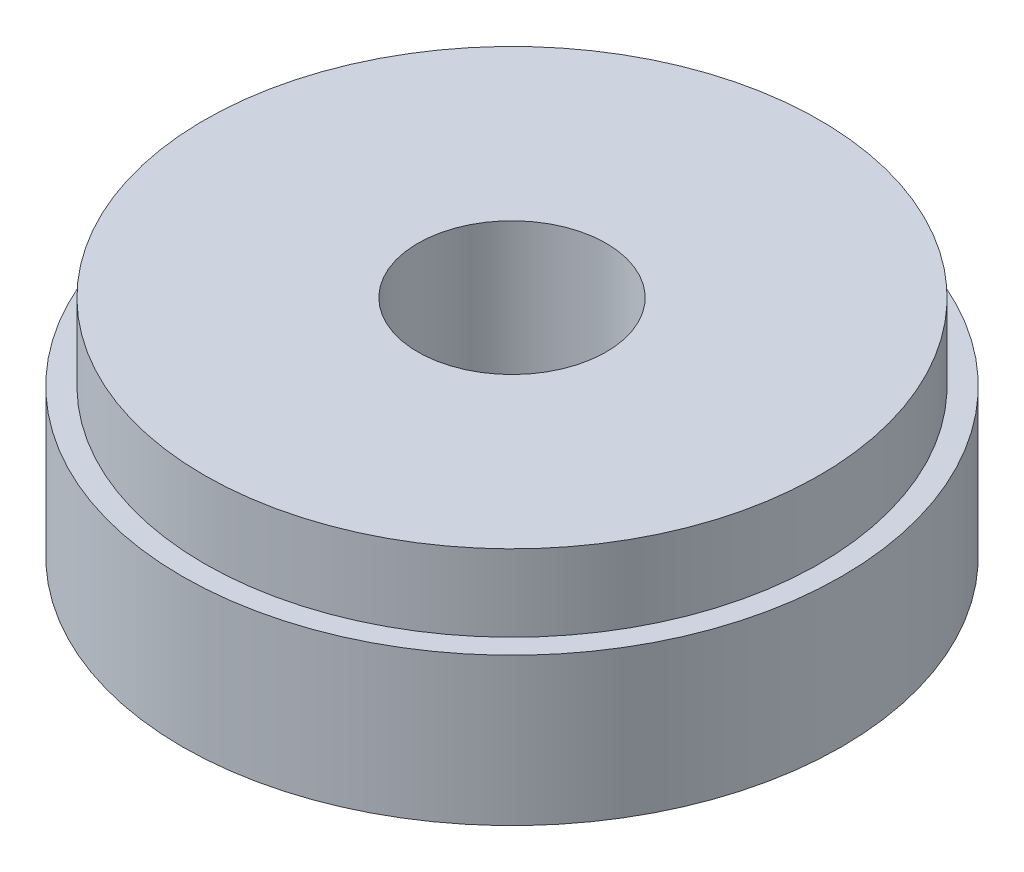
SolidWorks part; units mm, degrees
ref_plane "Front Plane" through (0, 0, 0) normal (0, 0, 1) x (1, 0, 0)
ref_plane "Top Plane" through (0, 0, 0) normal (0, 1, 0) x (1, 0, 0)
ref_plane "Right Plane" through (0, 0, 0) normal (1, 0, 0) x (0, 0, -1)
sketch "Sketch1" plane through (0, 0, 0) normal (0, 1, 0) x (1, 0, 0)
  circle A0 centre (0, 0) radius 21
  dimension "D1" = 42
extrude "Extrude1" add sketch "Sketch1" along normal blind 14.2748
sketch "Sketch2" plane through (0, 0, 0) normal (0, -1, 0) x (1, 0, 0)
  circle A0 centre (0, 0) radius 14
  dimension "D1" = 28
extrude "Extrude2" add sketch "Sketch2" along normal blind 3
sketch "Sketch6" plane through (0, 14.2748, 0) normal (0, 1, 0) x (-1, 0, 0)
  circle A0 centre (0, 0) radius 19.5961
  dimension "D1" = 39.1922
sketch "Sketch3" plane through (0, -3, 0) normal (0, -1, 0) x (1, 0, 0)
  circle A0 centre (0, 0) radius 6
  dimension "D1" = 12
extrude "Cut-Extrude1" cut sketch "Sketch3" against normal through all
hole_wizard "M4x0.7 Tapped Hole1" positions "Sketch5" profile "Sketch4" tap size "M4x0.7" standard "Ansi Metric"
sketch "Sketch5" plane through (0, 0, 0) normal (0, -1, 0) x (1, 0, 0)
  point P0 (17.5, 0)
  dimension "D1" = 17.5
sketch "Sketch4" plane through (17.5, 0, 0) normal (1, 0, 0) x (0, 0, -1)
  line L0 (0, 0) -> (0, 11.0914)
  line L1 (0, 11.0914) -> (1.65, 10.1)
  line L2 (1.65, 10.1) -> (1.65, 8)
  line L3 (1.65, 8) -> (2, 8)
  line L4 (2, 8) -> (2, 0)
  line L5 (2, 0) -> (0, 0)
  line L10 (0, 11.0914) -> (-1.65, 10.1) construction
  line L11 (0, -6.35) -> (0, 107.95) construction
  dimension "Tap Drill Dia." = 3.3
  dimension "Tap Drill Depth" = 10.1
  dimension "Thread Major Dia." = 4
  dimension "Thread Depth" = 8
  dimension "Drill Angle" = 118
pattern_circular "CirPattern1" count 4 over 360 about axis through (0, 0, 0) along (0, 1, 0) of "M4x0.7 Tapped Hole1"
extrude "Cut-Extrude2" cut sketch "Sketch6" against normal blind 4.8768 flip side to cut
hole_wizard "#4-40 Tapped Hole1" positions "Sketch8" profile "Sketch7" tap size "#4-40" standard "Ansi Inch"
sketch "Sketch8" plane through (0, 0, 0) normal (0, -1, 0) x (1, 0, 0)
  line L0 (0, 0) -> (22.5013, 0) construction
  line L1 (0, 0) -> (12.5724, -12.5724) construction
  line L2 (0, 0) -> (-12.5724, -12.5724) construction
  line L3 (0, 0) -> (-12.5724, 12.5724) construction
  line L4 (0, 0) -> (12.5724, 12.5724) construction
  circle A0 centre (0, 0) radius 17.78 construction
  point P0 (12.5724, -12.5724)
  point P1 (-12.5724, -12.5724)
  point P2 (-12.5724, 12.5724)
  point P3 (12.5724, 12.5724)
  dimension "D1" = 35.56
  dimension "D2" = 45
  dimension "D3" = 90
  dimension "D4" = 90
  dimension "D5" = 90
sketch "Sketch7" plane through (12.5724, 0, -12.5724) normal (1, 0, 0) x (0, 0, -1)
  line L0 (0, 0) -> (0, 8.2738)
  line L1 (0, 8.2738) -> (1.1303, 7.5946)
  line L2 (1.1303, 7.5946) -> (1.1303, 0)
  line L5 (1.1303, 0) -> (0, 0)
  line L10 (0, 8.2738) -> (-1.1303, 7.5946) construction
  line L11 (0, -6.35) -> (0, 107.95) construction
  dimension "Tap Drill Dia." = 2.2606
  dimension "Tap Drill Depth" = 7.5946
  dimension "Drill Angle" = 118
